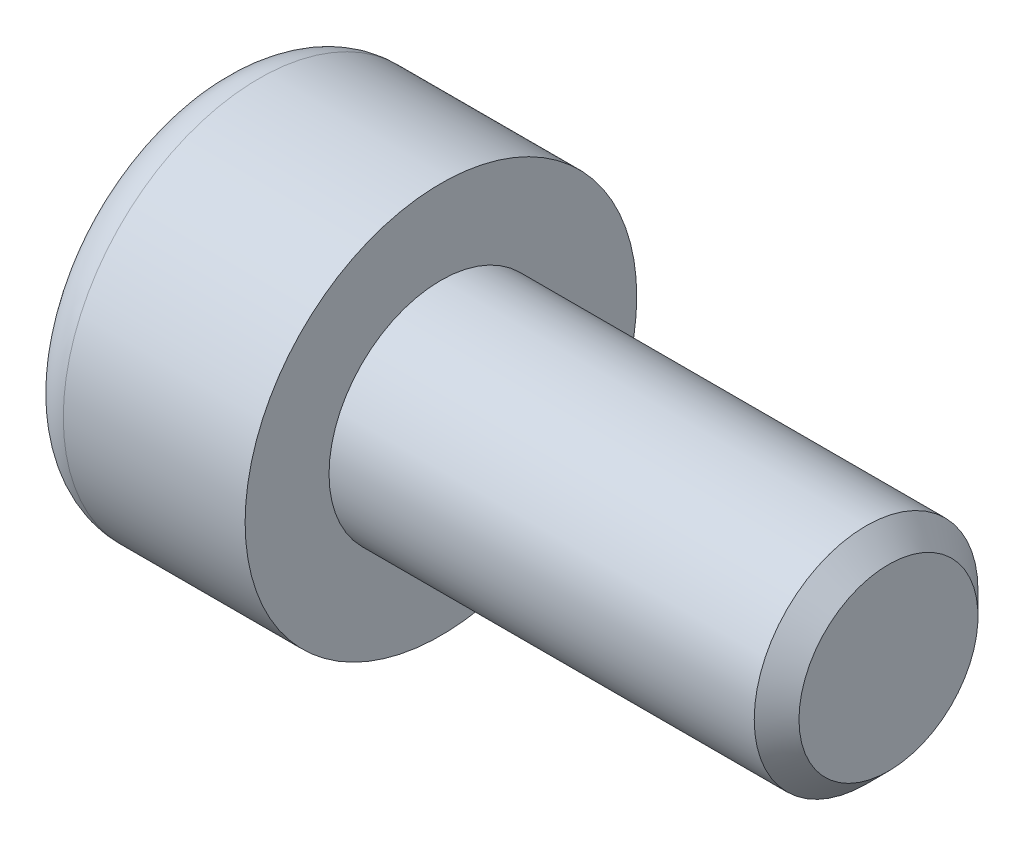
SolidWorks part; units mm, degrees
ref_plane "Face" through (0, 0, 0) normal (0, 0, 1) x (1, 0, 0)
ref_plane "Dessus" through (0, 0, 0) normal (0, 1, 0) x (1, 0, 0)
ref_plane "Droite" through (0, 0, 0) normal (1, 0, 0) x (0, 0, -1)
sketch "Esquisse1" plane through (0, 0, 0) normal (0, 0, 1) x (1, 0, 0)
  line L0 (-28.9827, 0) -> (28.9827, 0) construction
  line L1 (-4, 0) -> (-4, 3.5)
  line L2 (-4, 3.5) -> (0, 3.5)
  line L3 (0, 3.5) -> (0, 2)
  line L4 (0, 2) -> (8, 2)
  line L5 (8, 2) -> (8, 0)
  line L6 (8, 0) -> (-4, 0)
  dimension "D1" = 2
  dimension "D2" = 8
  dimension "D3" = 3.5
  dimension "D4" = 4
revolve "Base-Révolution" add sketch "Esquisse1" angle 360 about L0
chamfer "Chanfrein1" distance 0.4 angle 45 1 edges at (8, 0, 2)
fillet "Congé1" radius 0.75 1 edges at (-4, 0, 3.5)
sketch "Esquisse2" plane through (-4, 0, 0) normal (-1, 0, 0) x (0, 0, 1)
  line L0 (0.866, -1.5) -> (-0.866, -1.5)
  line L1 (-0.866, -1.5) -> (-1.7321, 0)
  line L2 (-1.7321, 0) -> (-0.866, 1.5)
  line L3 (-0.866, 1.5) -> (0.866, 1.5)
  line L4 (0.866, 1.5) -> (1.7321, 0)
  line L5 (1.7321, 0) -> (0.866, -1.5)
  circle A0 centre (0, 0) radius 1.5 construction
  dimension "D1" = 3
  dimension "D2" = 120
  dimension "D3" = 120
  dimension "D4" = 120
  dimension "D5" = 120
extrude "Enlèv. mat.-Extru.1" cut sketch "Esquisse2" against normal blind 2.5
